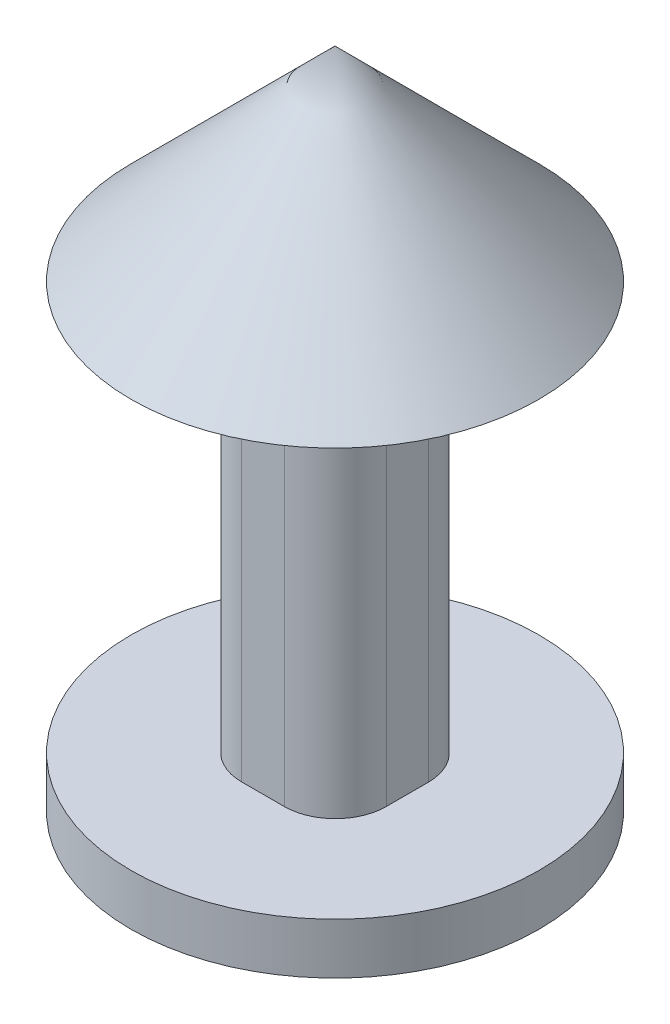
SolidWorks part; units mm, degrees
ref_plane "Front Plane" through (0, 0, 0) normal (0, 0, 1) x (1, 0, 0)
ref_plane "Top Plane" through (0, 0, 0) normal (0, 1, 0) x (1, 0, 0)
ref_plane "Right Plane" through (0, 0, 0) normal (1, 0, 0) x (0, 0, -1)
sketch "Sketch1" plane through (0, 0, 0) normal (0, 1, 0) x (1, 0, 0)
  circle A0 centre (0, 0) radius 101.6
  dimension "D1" = 203.2
extrude "Boss-Extrude1" add sketch "Sketch1" along normal blind 25.4
sketch "Sketch2" plane through (0, 25.4, 0) normal (0, 1, 0) x (1, 0, 0)
  line L0 (0, 0) -> (101.6, 0) construction
  line L1 (-10.5902, -35.8517) -> (10.5902, -35.8517)
  line L2 (-35.9902, -10.4517) -> (-35.9902, 10.4517)
  line L3 (-10.5902, 35.8517) -> (10.5902, 35.8517)
  line L4 (35.9902, -10.4517) -> (35.9902, 10.4517)
  line L5 (-35.9902, -35.8517) -> (35.9902, 35.8517) construction
  line L6 (-35.9902, 35.8517) -> (35.9902, -35.8517) construction
  circle A0 centre (0, 0) radius 101.6 construction
  arc A1 (-10.5902, -35.8517) -> (-35.9902, -10.4517) centre (-10.5902, -10.4517) cw
  arc A2 (10.5902, -35.8517) -> (35.9902, -10.4517) centre (10.5902, -10.4517) ccw
  arc A3 (-35.9902, 10.4517) -> (-10.5902, 35.8517) centre (-10.5902, 10.4517) cw
  arc A4 (10.5902, 35.8517) -> (35.9902, 10.4517) centre (10.5902, 10.4517) cw
  point P0 (0, 0)
  dimension "D1" = 25.4
extrude "Boss-Extrude2" add sketch "Sketch2" along normal blind 203.2
sketch "Sketch3" plane through (0, 0, 0) normal (0, 0, 1) x (1, 0, 0)
  line L0 (0, 228.6) -> (0, 394.8017) construction
  line L1 (-10.5902, 228.6) -> (10.5902, 228.6) construction
  line L2 (0, 228.6) -> (101.6, 228.6)
  line L3 (101.6, 228.6) -> (0, 330.2)
  line L4 (0, 330.2) -> (0, 228.6)
  point P5 (101.6, 25.4)
  dimension "D1" = 45
revolve "Revolve1" add sketch "Sketch3" angle 360 about L0
